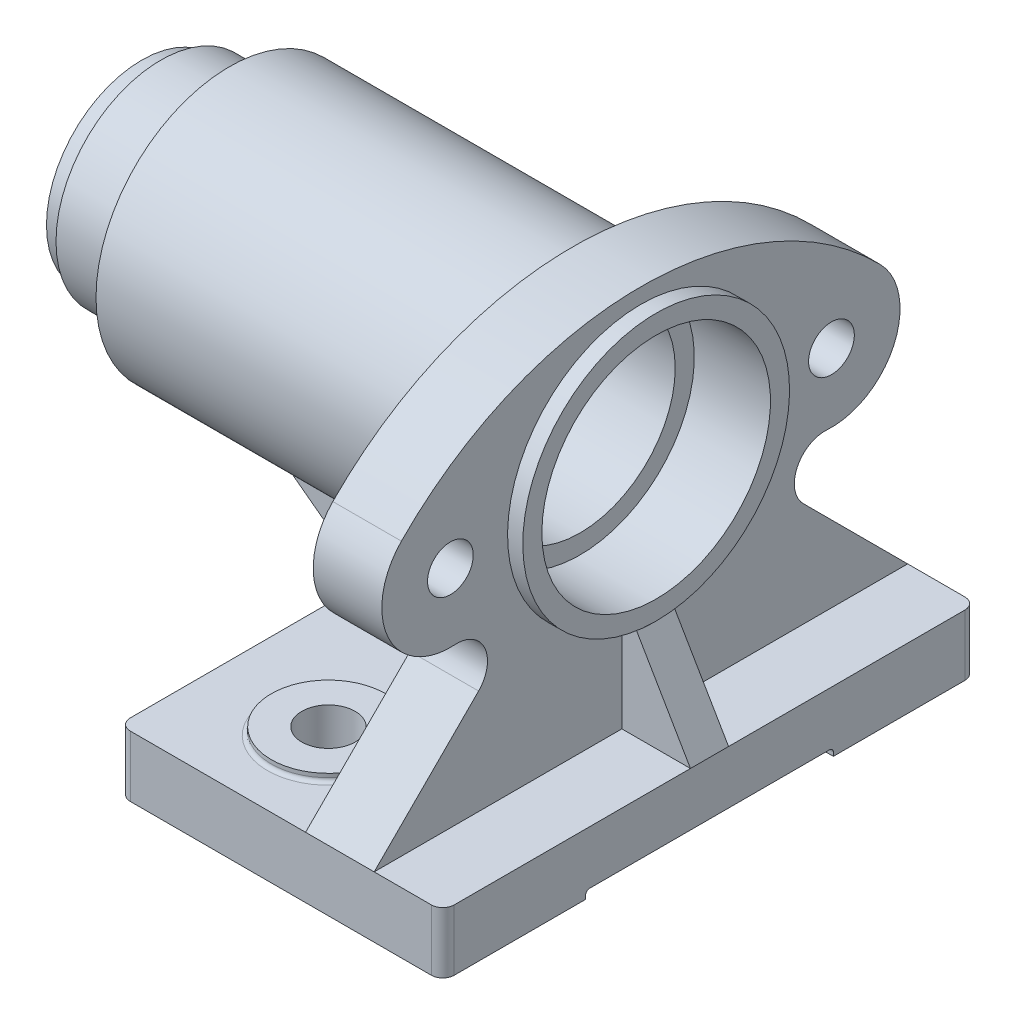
SolidWorks part; units mm, degrees
ref_plane "前视基准面" through (0, 0, 0) normal (0, 0, 1) x (1, 0, 0)
ref_plane "上视基准面" through (0, 0, 0) normal (0, 1, 0) x (1, 0, 0)
ref_plane "右视基准面" through (0, 0, 0) normal (1, 0, 0) x (0, 0, -1)
sketch "草图1" plane through (0, 0, 0) normal (0, 0, 1) x (1, 0, 0)
  line L0 (0, 0) -> (0, 16)
  line L1 (0, 16) -> (-85, 16)
  line L2 (-85, 16) -> (-85, 0)
  line L3 (-85, 0) -> (0, 0)
  dimension "D1" = 85
  dimension "D2" = 16
extrude "凸台-拉伸2" add sketch "草图1" along normal mid plane 140
ref_plane "基准面1" through (-14, 0, 0) normal (1, 0, 0) x (0, 0, -1)
sketch "草图2" plane through (0, 0, 0) normal (0, 0, 1) x (1, 0, 0)
  line L0 (-107.0679, 75) -> (-6.4484, 75) construction
  line L1 (-149, 91) -> (-149, 100)
  line L2 (-149, 100) -> (-144, 100)
  line L3 (-144, 100) -> (-144, 102.5)
  line L4 (-144, 102.5) -> (-126, 102.5)
  line L5 (-126, 102.5) -> (-126, 110)
  line L6 (-126, 110) -> (-14, 110)
  line L7 (-14, -8.8) -> (-14, 8.8) construction
  line L8 (-14, 110) -> (-14, 105)
  line L9 (-34, 100) -> (-114, 100)
  line L10 (-114, 100) -> (-114, 91)
  line L11 (-114, 91) -> (-149, 91)
  line L13 (-34, 100) -> (-34, 105)
  line L14 (-34, 105) -> (-14, 105)
  dimension "D1" = 35
  dimension "D2" = 30
  dimension "D3" = 25
  dimension "D4" = 18
  dimension "D5" = 112
  dimension "D6" = 135
  dimension "D7" = 20
  dimension "D8" = 80
  dimension "D9" = 16
  dimension "D10" = 75
  dimension "D11" = 25
  dimension "D12" = 27.5
revolve "旋转2" add sketch "草图2" angle 360 about L0
ref_plane "基准面2" through (-18, 0, 0) normal (1, 0, 0) x (0, 0, -1)
sketch "草图3" plane through (-18, 0, 0) normal (1, 0, 0) x (0, 0, -1)
  line L0 (0, -12.8905) -> (0, 132.0575) construction
  line L1 (77.2721, 75) -> (-87.1296, 75) construction
  line L2 (-50, 105.8207) -> (-50, 42.5784) construction
  line L3 (-70, 16) -> (-42.5982, 43.4018)
  line L4 (-70, 16) -> (70, 16) construction
  line L5 (-70, 16) -> (70, 16)
  line L6 (70, 16) -> (42.5982, 43.4018)
  circle A0 centre (-50, 75) radius 6
  arc A1 (-48.792, 57.0406) -> (-62.8571, 87.5974) centre (-50, 75) cw
  arc A2 (-42.5982, 43.4018) -> (-48.792, 57.0406) centre (-48.2551, 49.0586) ccw
  arc A3 (42.5982, 43.4018) -> (48.792, 57.0406) centre (48.2551, 49.0586) cw
  circle A4 centre (50, 75) radius 6
  arc A5 (48.792, 57.0406) -> (62.8571, 87.5974) centre (50, 75) ccw
  arc A6 (-62.8571, 87.5974) -> (62.8571, 87.5974) centre (0, 26.0102) cw
  circle A7 centre (0, 75) radius 35
  dimension "D2" = 12
  dimension "D3" = 18
  dimension "D4" = 8
  dimension "D6" = 88
  dimension "D7" = 70
  dimension "D1" = 50
  dimension "D5" = 45
extrude "凸台-拉伸3" add sketch "草图3" against normal blind 18
sketch "草图4" plane through (0, 0, 0) normal (0, 0, 1) x (1, 0, 0)
  line L0 (0, 16) -> (-14, 40)
  line L1 (-14, 40) -> (-14, 110) construction
rib "筋1" sketch "草图4" sketch "草图4" thickness 10 extrusion direction parallel to sketch draft on no parameters "D1"=10
sketch "草图5" plane through (0, 0, 0) normal (0, 0, 1) x (1, 0, 0)
  line L0 (-85, 16) -> (-117, 40)
  line L1 (-126, 40) -> (-36, 40) construction
  dimension "D1" = 32
rib "筋2" sketch "草图5" sketch "草图5" thickness 10 extrusion direction parallel to sketch draft on no parameters "D1"=10
sketch "草图7" plane through (0, 16, 0) normal (0, 1, 0) x (1, 0, 0)
  line L0 (15.7008, 0) -> (-171.889, 0) construction
  circle A0 centre (-55, 45) radius 15
  circle A1 centre (-55, -45) radius 15
  point P7 (-48.9933, 56.4624)
  dimension "D1" = 30
  dimension "D2" = 45
  dimension "D3" = 55
extrude "凸台-拉伸4" add sketch "草图7" along normal blind 2
sketch "草图8" plane through (0, 18, 0) normal (0, 1, 0) x (1, 0, 0)
  line L0 (-42.7326, 0) -> (-96.2966, 0) construction
  circle A0 centre (-55, 45) radius 7
  circle A1 centre (-55, -45) radius 7
  dimension "D1" = 14
extrude "切除-拉伸1" cut sketch "草图8" against normal blind 22
sketch "草图10" plane through (0, 0, 0) normal (1, 0, 0) x (0, 0, -1)
  line L0 (-32.5, 0) -> (-32.5, 2)
  line L1 (-70, 0) -> (70, 0) construction
  line L2 (-32.5, 2) -> (32.5, 2)
  line L3 (32.5, 2) -> (32.5, 0)
  line L4 (32.5, 0) -> (-32.5, 0)
  point P8 (0, 0)
  dimension "D1" = 2
  dimension "D2" = 32.5
  dimension "D3" = 32.5
extrude "切除-拉伸2" cut sketch "草图10" against normal blind 92
fillet "圆角2" radius 3 4 edges at (-85, 8, 70) (-85, 8, -70) (0, 8, -70) (0, 8, 70)
fillet "圆角3" radius 1 4 edges at (-40, 16, 45) (-40, 16, -45) (-42.5, 2, -32.5) (-42.5, 2, 32.5)
